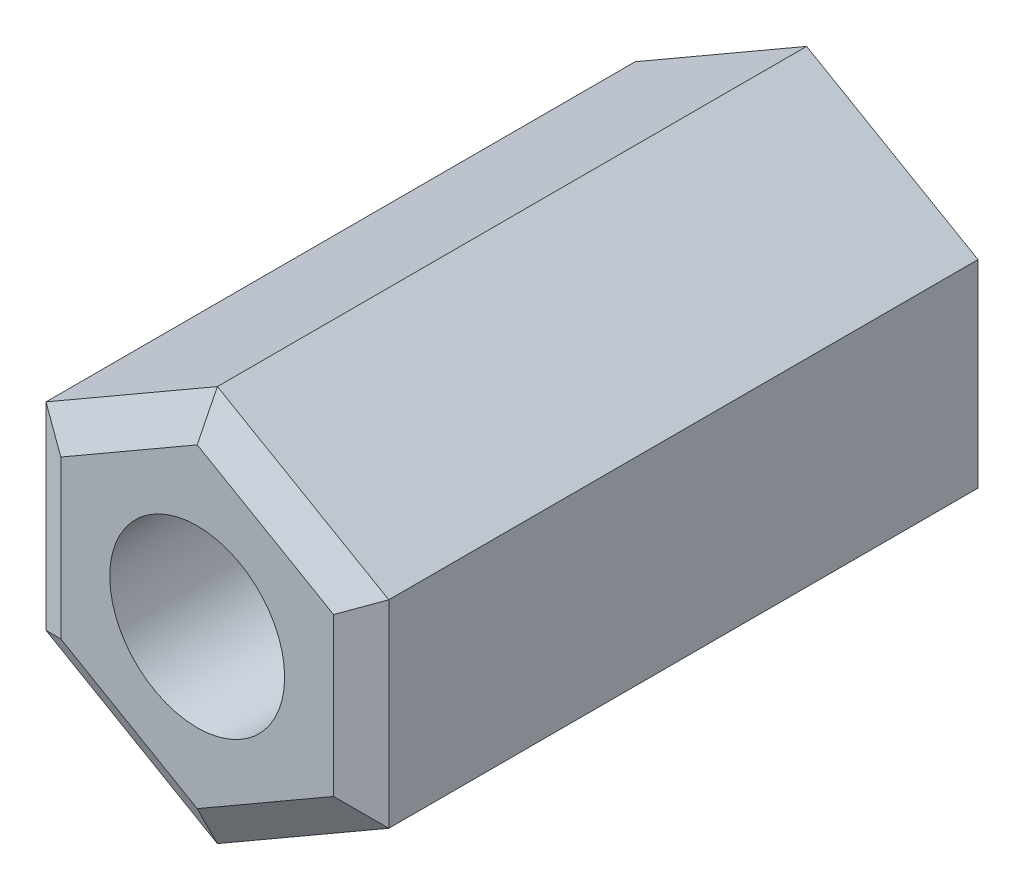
SolidWorks part; units mm, degrees
ref_plane "Plan de face" through (0, 0, 0) normal (0, 0, 1) x (1, 0, 0)
ref_plane "Plan de dessus" through (0, 0, 0) normal (0, 1, 0) x (1, 0, 0)
ref_plane "Plan de droite" through (0, 0, 0) normal (1, 0, 0) x (0, 0, -1)
sketch "Esquisse1" plane through (0, 0, 0) normal (0, 0, 1) x (1, 0, 0)
  line L1 (4.9, -2.829) -> (4.9, 2.829)
  line L2 (4.9, 2.829) -> (0, 5.658)
  line L3 (0, 5.658) -> (-4.9, 2.829)
  line L4 (-4.9, 2.829) -> (-4.9, -2.829)
  line L5 (-4.9, -2.829) -> (0, -5.658)
  line L6 (0, -5.658) -> (4.9, -2.829)
  circle A0 centre (0, 0) radius 4.9 construction
  dimension "D1" = 9.8
extrude "Boss.-Extru.1" add sketch "Esquisse1" along normal blind 18
hole_wizard "Trou taraudé M6x1.01" positions "Esquisse3" profile "Esquisse2" tap size "M6x1.0" standard "Ansi Metric"
sketch "Esquisse3" plane through (0, 0, 18) normal (0, 0, 1) x (1, 0, 0)
  point P0 (0, 0)
sketch "Esquisse2" plane through (0, 0, 18) normal (1, 0, 0) x (0, -1, 0)
  line L0 (0, 0) -> (0, 18)
  line L1 (0, 18) -> (2.5, 18)
  line L2 (2.5, 18) -> (2.5, 0)
  line L5 (2.5, 0) -> (0, 0)
  line L11 (0, -6.35) -> (0, 107.95) construction
  dimension "Diamètre du trou pour taraudage jusqu'au prochain" = 5
  dimension "Profondeur du trou pour taraudage jusqu'au prochain" = 18
chamfer "Chanfrein1" distance 1 angle 30 6 edges at (4.9, 0, 18) (2.45, -4.2435, 18) (-2.45, -4.2435, 18) (-4.9, 0, 18) (-2.45, 4.2435, 18) (2.45, 4.2435, 18)
chamfer "Chanfrein2" distance 1 angle 30 6 edges at (2.45, -4.2435, 0) (-2.45, -4.2435, 0) (-4.9, 0, 0) (-2.45, 4.2435, 0) (2.45, 4.2435, 0) (4.9, 0, 0)
